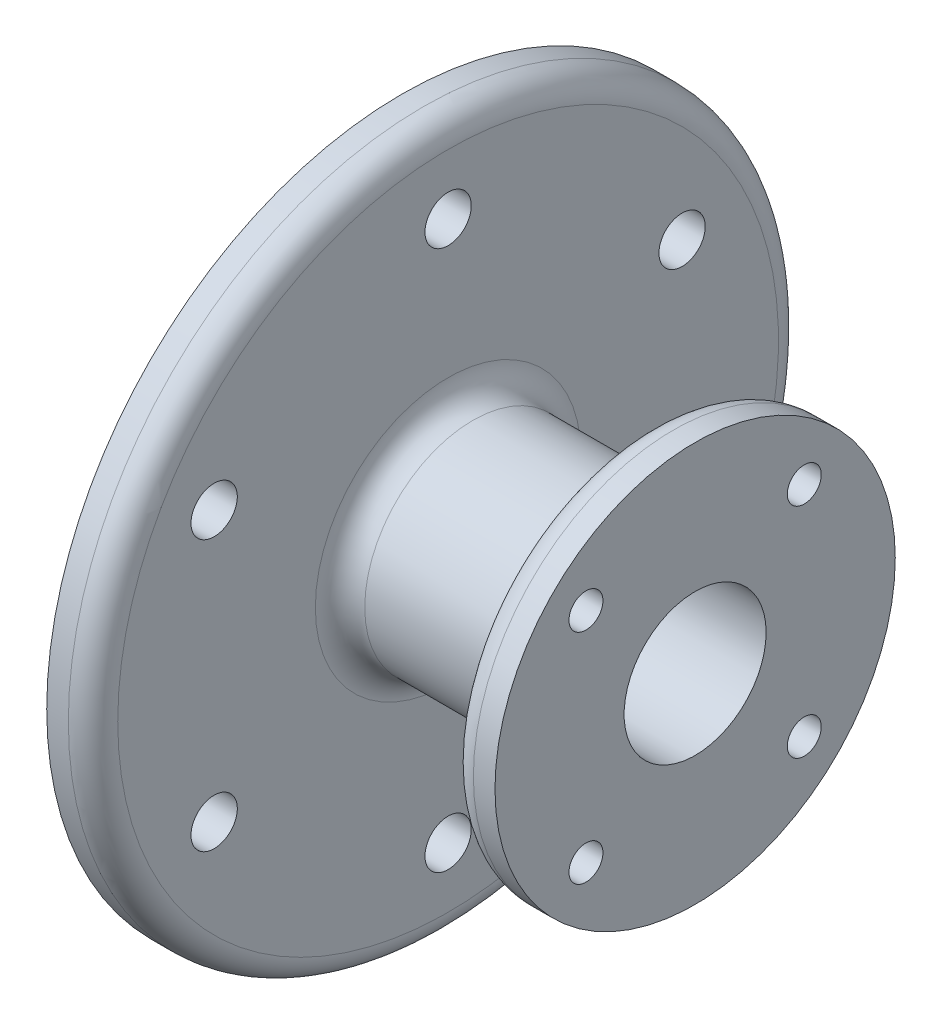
SolidWorks part; units mm, degrees
ref_plane "Plan de face" through (0, 0, 0) normal (0, 0, 1) x (1, 0, 0)
ref_plane "Plan de dessus" through (0, 0, 0) normal (0, 1, 0) x (1, 0, 0)
ref_plane "Plan de droite" through (0, 0, 0) normal (1, 0, 0) x (0, 0, -1)
sketch "Esquisse3" plane through (0, 0, 0) normal (0, 0, 1) x (1, 0, 0)
  line L0 (-153, -26) -> (-153, -153.6773) construction
  line L1 (-153, -113) -> (-153, -154.8245)
  line L2 (-153, -154.8245) -> (-168, -154.8245)
  line L3 (-153, -113) -> (-263, -113)
  line L4 (-168, -154.8245) -> (-168, -125)
  line L5 (-111.2294, -90) -> (-220.0413, -90) construction
  line L6 (-168, -125) -> (-233, -125)
  line L7 (-233, -125) -> (-233, -205)
  line L8 (-233, -205) -> (-248, -205)
  line L9 (-248, -205) -> (-248, -121)
  line L10 (-121.0195, -90) -> (-308.7512, -90) construction
  line L11 (-248, -121) -> (-263, -121)
  line L12 (-263, -113) -> (-263, -121)
  dimension "D1" = 23
  dimension "D2" = 15
  dimension "D3" = 15
  dimension "D4" = 35
  dimension "D5" = 65
  dimension "D6" = 115
  dimension "D7" = 8
  dimension "D8" = 15
revolve "Révolution1" add sketch "Esquisse3" angle 360 about L10
fillet "Congé1" radius 8 4 edges at (-233, -90, -115) (-233, -90, -35) (-168, -90, -35) (-168, -90, -64.8245)
sketch "Esquisse4" plane through (-168, 0, 0) normal (-1, 0, 0) x (0, 0, 1)
  circle A0 centre (-35.3553, -125.3553) radius 5.5 construction
  circle A1 centre (35.3553, -125.3553) radius 5.5 construction
  circle A2 centre (35.3553, -54.6447) radius 5.5 construction
  circle A3 centre (-35.3553, -54.6447) radius 5.5 construction
  circle A4 centre (-35.3553, -125.3553) radius 5.5
  circle A5 centre (35.3553, -125.3553) radius 5.5
  circle A6 centre (35.3553, -54.6447) radius 5.5
  circle A7 centre (-35.3553, -54.6447) radius 5.5
extrude "Enlèv. mat.-Extru.1" cut sketch "Esquisse4" against normal up to next
chamfer "Chanfrein1" distance 3 angle 45 1 edges at (-263, -90, -31)
sketch "Esquisse5" plane through (-248, 0, 0) normal (-1, 0, 0) x (0, 0, 1)
  circle A0 centre (0, -90) radius 87.5 construction
  circle A1 centre (0, -2.5) radius 7.5
  dimension "D1" = 175
  dimension "D2" = 15
extrude "Extrusion1" cut sketch "Esquisse5" against normal up to next
pattern_circular "Répétition circulaire1" count 6 over 360 about axis through (0, -90, 0) along (1, 0, 0) of "Extrusion1"
